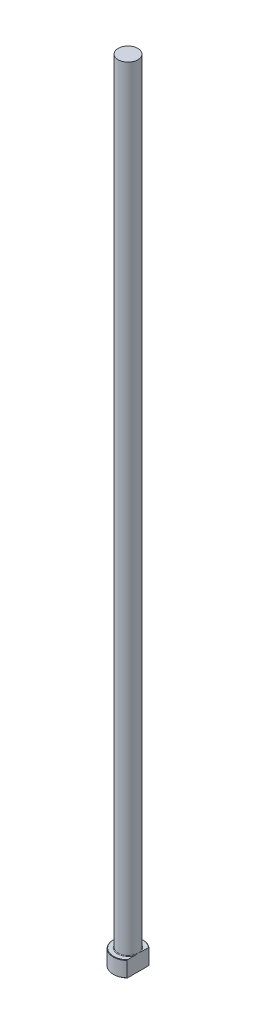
SolidWorks part; units mm, degrees
ref_plane "Front Plane" through (0, 0, 0) normal (0, 0, 1) x (1, 0, 0)
ref_plane "Top Plane" through (0, 0, 0) normal (0, 1, 0) x (1, 0, 0)
ref_plane "Right Plane" through (0, 0, 0) normal (1, 0, 0) x (0, 0, -1)
sketch "Sketch1" plane through (0, 0, 0) normal (0, 0, 1) x (1, 0, 0)
  line L0 (0, 259.9588) -> (0, -15.1925) construction
  line L1 (0, 0) -> (-7.5, 0)
  line L2 (-7.5, 0) -> (-7.5, 8)
  line L3 (-7.5, 8) -> (-5, 8)
  line L4 (-5, 8) -> (-5, 400)
  line L5 (-5, 400) -> (0, 400)
  line L6 (0, 400) -> (0, 0)
  dimension "L" = 400
  dimension "H" = 15
  dimension "T" = 8
  dimension "D" = 10
revolve "Revolve1" add sketch "Sketch1" angle 360 about L0
chamfer "Chamfer1" distance 0.2 angle 45 2 edges at (0, 8, 7.5) (0, 0, 7.5)
fillet "Fillet1" radius 0.3 1 edges at (0, 8, 5)
sketch "Sketch2" plane through (0, 0, 0) normal (0, 1, 0) x (1, 0, 0)
  line L0 (5, -5.5902) -> (5, 5.5902)
  circle A0 centre (0, 0) radius 7.5 construction
  arc A1 (5, -5.5902) -> (5, 5.5902) centre (0, 0) ccw
  circle A2 centre (0, 0) radius 5 construction
extrude "KEYED HEAD" cut sketch "Sketch2" along normal through all
